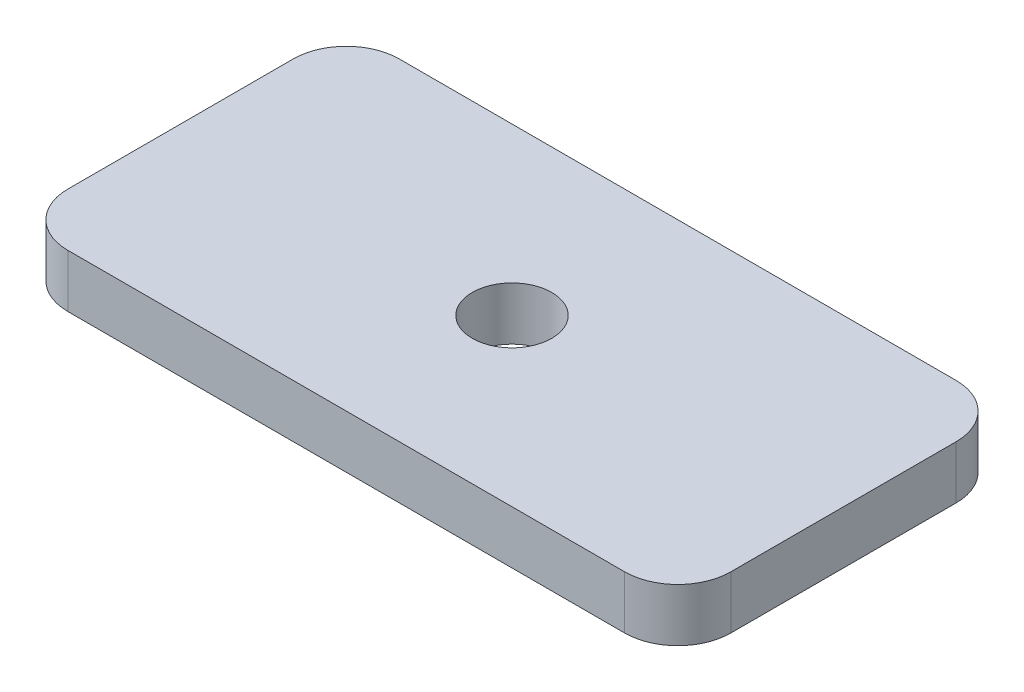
SolidWorks part; units mm, degrees
ref_plane "Plan de face" through (0, 0, 0) normal (0, 0, 1) x (1, 0, 0)
ref_plane "Plan de dessus" through (0, 0, 0) normal (0, 1, 0) x (1, 0, 0)
ref_plane "Plan de droite" through (0, 0, 0) normal (1, 0, 0) x (0, 0, -1)
sketch "Esquisse1" plane through (0, 0, 0) normal (0, 1, 0) x (1, 0, 0)
  line L1 (-42, 25) -> (42, 25)
  line L2 (-50, 17) -> (-50, -17)
  line L3 (-42, -25) -> (42, -25)
  line L4 (50, 17) -> (50, -17)
  line L5 (-50, 25) -> (50, -25) construction
  line L6 (-50, -25) -> (50, 25) construction
  arc A0 (42, 25) -> (50, 17) centre (42, 17) cw
  arc A1 (42, -25) -> (50, -17) centre (42, -17) ccw
  arc A2 (-50, -17) -> (-42, -25) centre (-42, -17) ccw
  arc A3 (-42, 25) -> (-50, 17) centre (-42, 17) ccw
  point P0 (0, 0)
  dimension "D1" = 8
  dimension "D2" = 50
  dimension "D3" = 100
extrude "Boss.-Extru.1" add sketch "Esquisse1" along normal blind 8
sketch "Esquisse2" plane through (0, 8, 0) normal (0, 1, 0) x (1, 0, 0)
  circle A0 centre (0, 0) radius 6
  dimension "D1" = 12
extrude "Enlèv. mat.-Extru.1" cut sketch "Esquisse2" against normal through all
